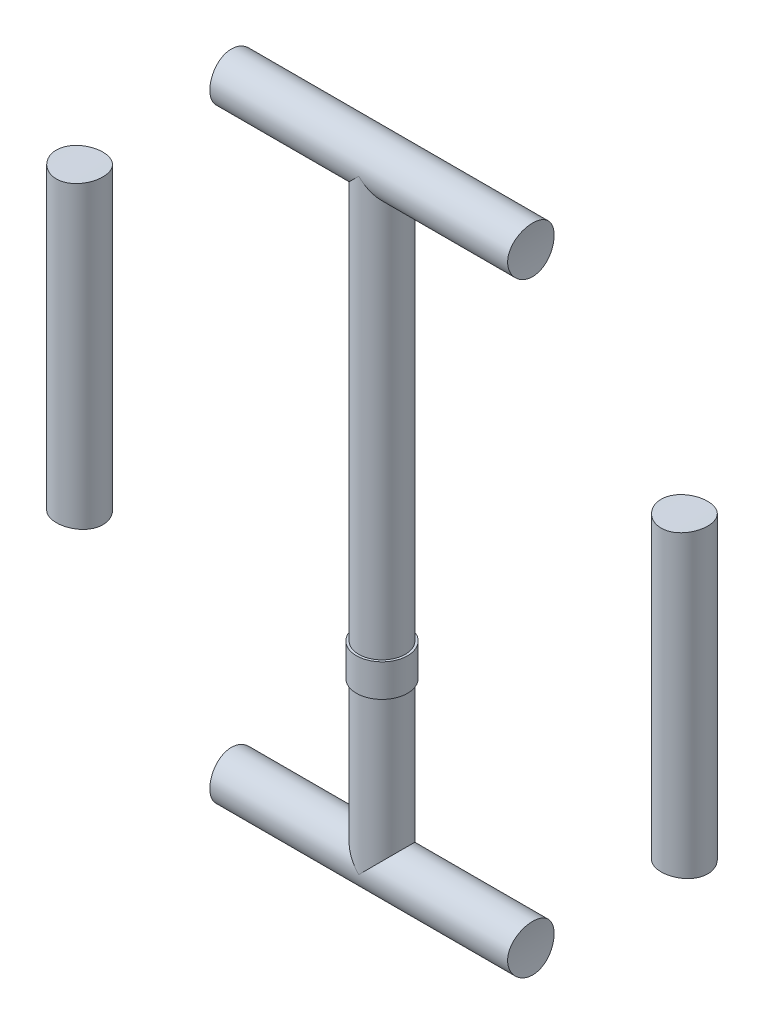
SolidWorks part; units mm, degrees
ref_plane "Спереди" through (0, 0, 0) normal (0, 0, 1) x (1, 0, 0)
ref_plane "Сверху" through (0, 0, 0) normal (0, 1, 0) x (1, 0, 0)
ref_plane "Справа" through (0, 0, 0) normal (1, 0, 0) x (0, 0, -1)
sketch "Sketch1" plane through (0, 0, 0) normal (0, 0, 1) x (1, 0, 0)
  line L0 (0, -650) -> (0, -310) construction
  line L1 (-650, 650) -> (650, 650)
  line L2 (-650, 650) -> (-650, -650)
  line L3 (-650, -650) -> (650, -650)
  line L4 (650, 650) -> (650, -650)
  line L5 (-650, 650) -> (650, -650) construction
  line L6 (-650, -650) -> (650, 650) construction
  point P0 (0, 0)
  dimension "D1" = 1300
  dimension "D2" = 1300
  dimension "D3" = 340
sketch "Sketch2" plane through (0, 0, 0) normal (1, 0, 0) x (0, 0, -1)
  circle A0 centre (0, 650) radius 50
  dimension "D1" = 100
sweep "Sweep1" add profiles "Sketch2" path "Sketch1"
sketch "Sketch3" plane through (0, 0, 0) normal (0, 1, 0) x (1, 0, 0)
  circle A0 centre (0, 0) radius 50
  dimension "D1" = 100
extrude "Boss-Extrude1" add sketch "Sketch3" along normal up to surface and the other way up to surface
sketch "Sketch4" plane through (0, 0, 0) normal (0, 0, 1) x (1, 0, 0)
  circle A0 centre (-650, 650) radius 330
  circle A1 centre (-650, -650) radius 330
  circle A2 centre (650, -650) radius 330
  circle A3 centre (650, 650) radius 330
  dimension "D1" = 660
extrude "Cut-Extrude2" cut sketch "Sketch4" against normal through all and the other way through all
ref_plane "Plane1" through (0, -310, 0) normal (0, 1, 0) x (1, 0, 0)
sketch "Sketch5" plane through (0, -310, 0) normal (0, 1, 0) x (1, 0, 0)
  circle A0 centre (0, 0) radius 55
  dimension "D1" = 110
extrude "Boss-Extrude2" add sketch "Sketch5" along normal blind 70
